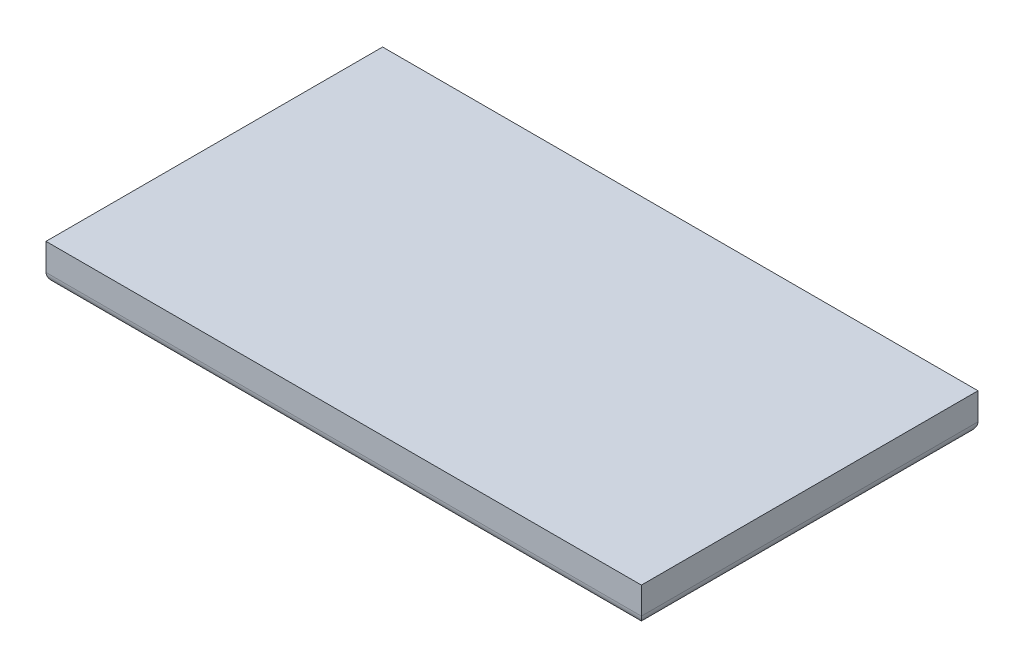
SolidWorks part; units mm, degrees
ref_plane "Front Plane" through (0, 0, 0) normal (0, 0, 1) x (1, 0, 0)
ref_plane "Top Plane" through (0, 0, 0) normal (0, 1, 0) x (1, 0, 0)
ref_plane "Right Plane" through (0, 0, 0) normal (1, 0, 0) x (0, 0, -1)
sketch "Sketch1" plane through (0, 0, 0) normal (0, 1, 0) x (1, 0, 0)
  line L1 (-8.844, 5) -> (8.844, 5)
  line L2 (-8.844, 5) -> (-8.844, -5)
  line L3 (-8.844, -5) -> (8.844, -5)
  line L4 (8.844, 5) -> (8.844, -5)
  line L5 (-8.844, 5) -> (8.844, -5) construction
  line L6 (-8.844, -5) -> (8.844, 5) construction
  point P0 (0, 0)
  dimension "D1" = 17.688
  dimension "D2" = 10
extrude "Boss-Extrude1" add sketch "Sketch1" along normal blind 1.1
fillet "Fillet1" radius 0.3 4 edges at (0, 0, -5) (-8.844, 0, 0) (0, 0, 5) (8.844, 0, 0)
